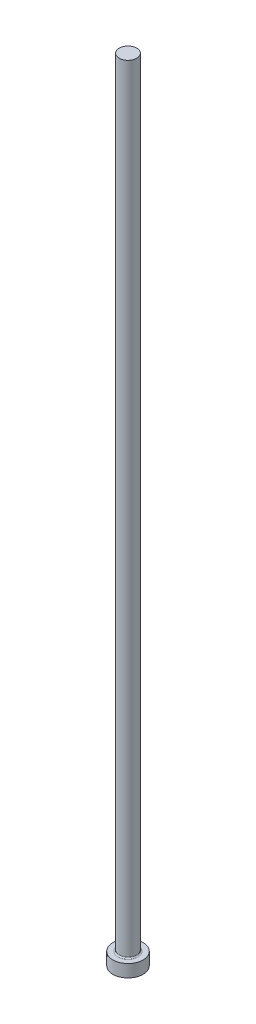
SolidWorks part; units mm, degrees
ref_plane "Plano frontal" through (0, 0, 0) normal (0, 0, 1) x (1, 0, 0)
ref_plane "Plano superior" through (0, 0, 0) normal (0, 1, 0) x (1, 0, 0)
ref_plane "Plano direito" through (0, 0, 0) normal (1, 0, 0) x (0, 0, -1)
sketch "Esboço1" plane through (0, 0, 0) normal (0, 0, 1) x (1, 0, 0)
  line L0 (0, 0) -> (6, 0)
  line L1 (6, 0) -> (6, 5)
  line L2 (6, 5) -> (4, 5)
  line L3 (3.5, 5.5) -> (3.5, 315)
  line L4 (3.5, 315) -> (0, 315)
  line L5 (0, 315) -> (0, 0) construction
  line L6 (0, 0) -> (0, 315)
  arc A0 (4, 5) -> (3.5, 5.5) centre (4, 5.5) cw
  dimension "D3" = 0.5
  dimension "D1" = 12
  dimension "D2" = 7
  dimension "D4" = 5
  dimension "D5" = 315
revolve "Revolução1" add sketch "Esboço1" angle 360 about L5
sketch "Esboço2"
  dimension "D1" = 1.05
  dimension "D2" = 0.675
  dimension "D3" = 3.225
  dimension "D4" = 0.45
wrap "Envolver1" sketch "Esboço2" wrap type deboss source sketch "Esboço2" thickness 0.1 parameters "D1"=0.1
